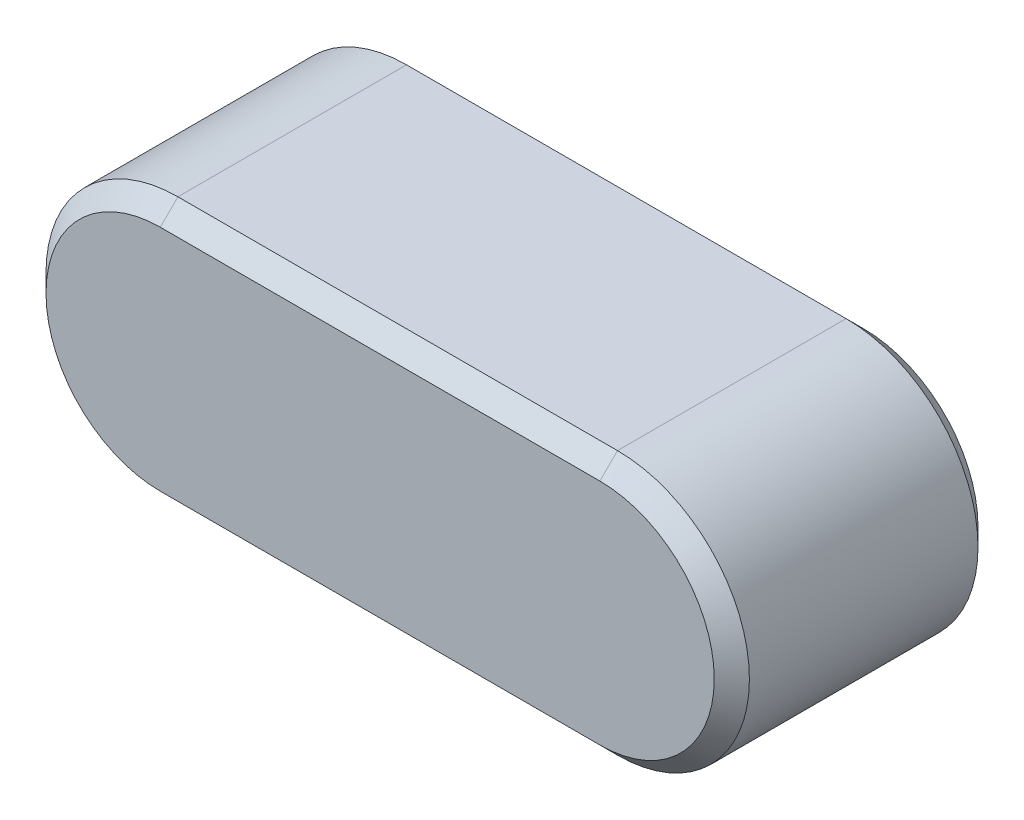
SolidWorks part; units mm, degrees
ref_plane "Front" through (0, 0, 0) normal (0, 0, 1) x (1, 0, 0)
ref_plane "Top" through (0, 0, 0) normal (0, 1, 0) x (1, 0, 0)
ref_plane "Right" through (0, 0, 0) normal (1, 0, 0) x (0, 0, -1)
other "Configuration Table"
sketch "Sketch1" plane through (0, 0, 0) normal (0, 0, 1) x (1, 0, 0)
  line L0 (-5, 1.5) -> (0, 1.5)
  line L1 (0, -1.5) -> (-5, -1.5)
  arc A0 (0, 1.5) -> (0, -1.5) centre (0, 0) cw
  arc A1 (-5, -1.5) -> (-5, 1.5) centre (-5, 0) cw
  dimension "L" = 8
  dimension "b" = 3
extrude "BaseKey" add sketch "Sketch1" along normal mid plane 3
sketch "Sketch2" plane through (0, 0, 0) normal (0, 0, 1) x (1, 0, 0)
  line L1 (-6.5, 1.5) -> (1.5, 1.5)
  line L2 (-6.5, 1.5) -> (-6.5, -1.5)
  line L3 (-6.5, -1.5) -> (1.5, -1.5)
  line L4 (1.5, 1.5) -> (1.5, -1.5)
  line L6 (0, -1.5) -> (-5, -1.5) construction
  line L7 (-5, 1.5) -> (0, 1.5) construction
  arc A2 (0, -1.5) -> (0, 1.5) centre (0, 0) ccw construction
  arc A3 (-5, 1.5) -> (-5, -1.5) centre (-5, 0) ccw construction
extrude "Extrude1" [suppressed] add sketch "Sketch2" along normal mid plane 3
sketch "Sketch3" plane through (0, 0, 0) normal (0, 0, 1) x (1, 0, 0)
  line L0 (1.5, 1.5) -> (-5, 1.5)
  line L1 (-5, -1.5) -> (1.5, -1.5)
  line L2 (1.5, -1.5) -> (1.5, 1.5)
  line L5 (-5, 1.5) -> (0, 1.5) construction
  arc A0 (-5, 1.5) -> (-5, -1.5) centre (-5, 0) ccw
  arc A1 (0, -1.5) -> (0, 1.5) centre (0, 0) ccw construction
  arc A4 (-5, 1.5) -> (-5, -1.5) centre (-5, 0) ccw construction
extrude "Extrude2" [suppressed] add sketch "Sketch3" along normal mid plane 3
chamfer "Chamfer1" distance 0.2 angle 45 8 edges at (1.5, 0, -1.5) (-2.5, -1.5, -1.5) (-6.5, 0, -1.5) (-2.5, 1.5, -1.5) (-6.5, 0, 1.5) (-2.5, -1.5, 1.5) (1.5, 0, 1.5) (-2.5, 1.5, 1.5)
equation "\"D1@Extrude1\"=\"h@BaseKey\""
equation "\"D1@Extrude2\"=\"h@BaseKey\""
